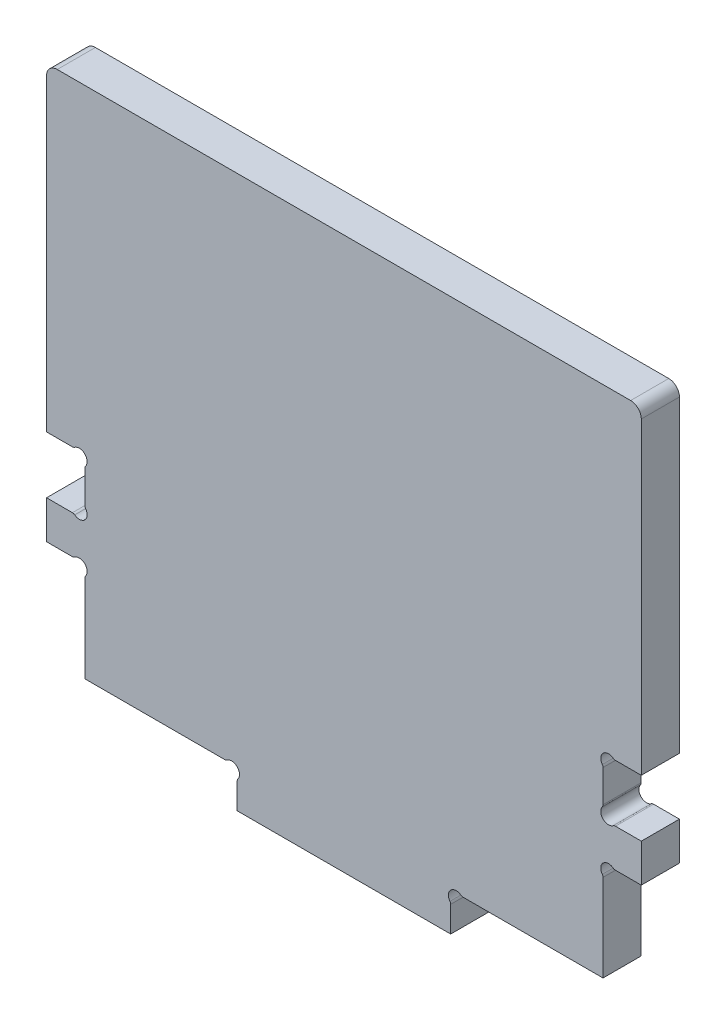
SolidWorks part; units mm, degrees
ref_plane "Plan de face" through (0, 0, 0) normal (0, 0, 1) x (1, 0, 0)
ref_plane "Plan de dessus" through (0, 0, 0) normal (0, 1, 0) x (1, 0, 0)
ref_plane "Plan de droite" through (0, 0, 0) normal (1, 0, 0) x (0, 0, -1)
sketch "Esquisse2" plane through (0, 0, 0) normal (0, 0, 1) x (1, 0, 0)
  line L0 (-125, 102.7777) -> (-99.9, 102.7777) construction
  line L2 (0, 16.869) -> (0, 0)
  line L3 (-8.131, 25) -> (-99.9, 25)
  line L4 (-99.9, 82.1466) -> (-99.9, 25)
  line L5 (-125, 362) -> (265, 362)
  line L6 (-125, 90.2777) -> (-125, 115.2777)
  line L7 (0, 0) -> (140, 0)
  line L8 (-108.031, 90.2777) -> (-125, 90.2777)
  line L9 (-108.031, 115.2777) -> (-125, 115.2777)
  line L10 (-125, 152.6553) -> (-125, 362)
  line L11 (-99.9, 123.4087) -> (-99.9, 144.5243)
  line L12 (-125, 152.6553) -> (-108.031, 152.6553)
  line L13 (70, 0) -> (70, 362) construction
  line L14 (0, 25) -> (-3.6062, 21.3938) construction
  line L15 (-99.9, 90.2777) -> (-103.5062, 86.6714) construction
  line L16 (-99.9, 115.2777) -> (-103.5062, 118.8839) construction
  line L17 (-99.9, 152.6553) -> (-103.5062, 149.0491) construction
  line L18 (265, 152.6553) -> (265, 362)
  line L19 (265, 152.6553) -> (248.031, 152.6553)
  line L20 (239.9, 123.4087) -> (239.9, 144.5243)
  line L21 (248.031, 115.2777) -> (265, 115.2777)
  line L22 (265, 90.2777) -> (265, 115.2777)
  line L23 (248.031, 90.2777) -> (265, 90.2777)
  line L24 (239.9, 82.1466) -> (239.9, 25)
  line L25 (148.131, 25) -> (239.9, 25)
  line L26 (140, 16.869) -> (140, 0)
  line L27 (-160.9024, 25) -> (-160.9024, 90.2777) construction
  line L28 (-160.9024, 90.2777) -> (-160.9024, 115.2777) construction
  line L29 (-160.9024, 115.2777) -> (-160.9024, 150.5553) construction
  line L30 (-160.9024, 115.2777) -> (-135.9024, 115.2777) construction
  line L31 (-135.9024, 115.2777) -> (-135.9024, 90.2777) construction
  line L32 (-135.9024, 90.2777) -> (-160.9024, 90.2777) construction
  line L33 (-160.9731, 115.3484) -> (-135.8317, 90.207) construction
  line L34 (-160.9024, 90.2777) -> (-135.9024, 115.2777) construction
  line L35 (-148.4024, 85) -> (-160.9024, 85) construction
  line L36 (-148.4024, 120.5553) -> (-160.9024, 120.5553) construction
  arc A0 (0.4914, 18.3574) -> (-6.6426, 25.4914) centre (-3.6062, 21.3938) ccw
  arc A1 (0, 16.869) -> (0.4914, 18.3574) centre (2.5, 16.869) cw
  arc A2 (-6.6426, 25.4914) -> (-8.131, 25) centre (-8.131, 27.5) cw
  arc A3 (-99.4086, 83.635) -> (-106.5426, 90.769) centre (-103.5062, 86.6714) ccw
  arc A4 (-99.9, 82.1466) -> (-99.4086, 83.635) centre (-97.4, 82.1466) cw
  arc A5 (-106.5426, 90.769) -> (-108.031, 90.2777) centre (-108.031, 92.7777) cw
  arc A6 (-106.5426, 114.7863) -> (-99.4086, 121.9203) centre (-103.5062, 118.8839) ccw
  arc A7 (-108.031, 115.2777) -> (-106.5426, 114.7863) centre (-108.031, 112.7777) cw
  arc A8 (-99.4086, 121.9203) -> (-99.9, 123.4087) centre (-97.4, 123.4087) cw
  arc A9 (-99.4086, 146.0127) -> (-106.5426, 153.1467) centre (-103.5062, 149.0491) ccw
  arc A10 (-99.9, 144.5243) -> (-99.4086, 146.0127) centre (-97.4, 144.5243) cw
  arc A11 (-106.5426, 153.1467) -> (-108.031, 152.6553) centre (-108.031, 155.1553) cw
  arc A12 (246.5426, 153.1467) -> (248.031, 152.6553) centre (248.031, 155.1553) ccw
  arc A13 (239.4086, 146.0127) -> (246.5426, 153.1467) centre (243.5062, 149.0491) cw
  arc A14 (239.9, 144.5243) -> (239.4086, 146.0127) centre (237.4, 144.5243) ccw
  arc A15 (239.4086, 121.9203) -> (239.9, 123.4087) centre (237.4, 123.4087) ccw
  arc A16 (246.5426, 114.7863) -> (239.4086, 121.9203) centre (243.5062, 118.8839) cw
  arc A17 (248.031, 115.2777) -> (246.5426, 114.7863) centre (248.031, 112.7777) ccw
  arc A18 (246.5426, 90.769) -> (248.031, 90.2777) centre (248.031, 92.7777) ccw
  arc A19 (239.4086, 83.635) -> (246.5426, 90.769) centre (243.5062, 86.6714) cw
  arc A20 (239.9, 82.1466) -> (239.4086, 83.635) centre (237.4, 82.1466) ccw
  arc A21 (146.6426, 25.4914) -> (148.131, 25) centre (148.131, 27.5) ccw
  arc A22 (139.5086, 18.3574) -> (146.6426, 25.4914) centre (143.6062, 21.3938) cw
  arc A23 (140, 16.869) -> (139.5086, 18.3574) centre (137.5, 16.869) ccw
  circle A24 centre (-148.4024, 102.7777) radius 17.7777 construction
  point P2 (-125, 102.7777)
  point P87 (-148.4024, 102.7777)
  point P88 (-148.4024, 102.7777)
extrude "Boss.-Extru.2" add sketch "Esquisse2" along normal blind 25
fillet "Congé1" radius 7 2 edges at (265, 362, 12.5) (-125, 362, 12.5)
equation "\"D1@Boss.-Extru.2\" = \"material_thickness\""
equation "\"tool_diameter\"=10"
equation "\"hole_clearance\"=0.1"
equation "\"material_thickness\"=25"
equation "\"clearance\"=0.1"
equation "\"outer_slot\"=0.5"
equation "\"fillet\"=7"
equation "\"string\"= 2 * \"tool_diameter\" / 2 * cos ( 45deg )"
equation "\"angle\"= IIF ( \"string\" < \"limit\" , 45 , ( 180 - 2 * arcsin ( \"ThicknessVStool_dia\" ) ) / 2 )"
equation "\"limit\"= \"material_thickness\" / 2 * 5 / 6"
equation "\"ThicknessVStool_dia\"= IIF ( \"limit\" / \"tool_diameter\" > 1 , 1 , \"limit\" / \"tool_diameter\" )"
equation "\"D1@Congé1\"=\"fillet\""
equation "\"D1@Esquisse2\"=\"material_thickness\" +\"clearance\""
equation "\"D2@Esquisse2\"= \"tool_diameter\" / 2 + \"hole_clearance\""
equation "\"D3@Esquisse2\"=\"material_thickness\"/10"
equation "\"D12@Esquisse2\"=\"material_thickness\""
equation "\"D15@Esquisse2\"=\"material_thickness\""
equation "\"D20@Esquisse2\"=330 + \"fillet\""
equation "\"D17@Esquisse2\"=170 +\"material_thickness\""
equation "\"D5@Esquisse2\"=\"material_thickness\"/10"
equation "\"D4@Esquisse2\"=\"tool_diameter\"/2 +\"hole_clearance\""
equation "\"D8@Esquisse2\"=\"hole_clearance\""
equation "\"D9@Esquisse2\"=\"clearance\" + 2"
